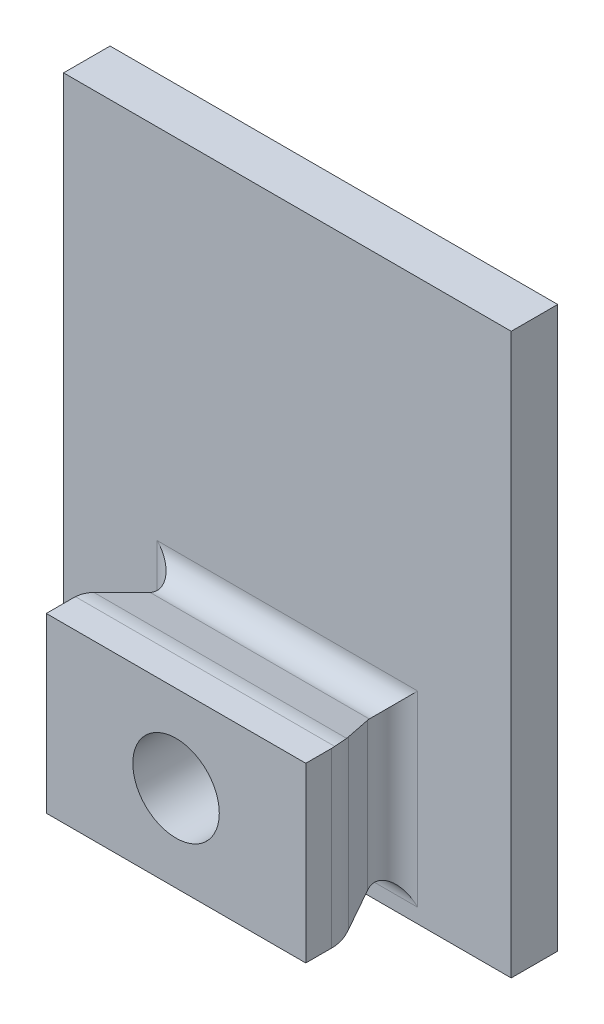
SolidWorks part; units mm, degrees
ref_plane "Plan de face" through (0, 0, 0) normal (0, 0, 1) x (1, 0, 0)
ref_plane "Plan de dessus" through (0, 0, 0) normal (0, 1, 0) x (1, 0, 0)
ref_plane "Plan de droite" through (0, 0, 0) normal (1, 0, 0) x (0, 0, -1)
sketch "Esquisse1" plane through (0, 0, 0) normal (0, 0, 1) x (1, 0, 0)
  line L1 (-60, 40) -> (60, 40)
  line L2 (-60, 40) -> (-60, -40)
  line L3 (-60, -40) -> (60, -40)
  line L4 (60, 40) -> (60, -40)
  dimension "D1" = 120
  dimension "D2" = 80
  dimension "D3" = 40
  dimension "D4" = 60
extrude "Boss.-Extru.1" add sketch "Esquisse1" along normal blind 17
ref_plane "Plan1" through (0, 0, -34.5) normal (0, 0, 1) x (1, 0, 0)
sketch "Esquisse2" plane through (0, 0, -34.5) normal (0, 0, 1) x (1, 0, 0)
  line L0 (60, -40) -> (60, 40) construction
  line L1 (45, -30) -> (-45, -30)
  line L2 (45, -30) -> (45, 30)
  line L3 (45, 30) -> (-45, 30)
  line L4 (-45, -30) -> (-45, 30)
  line L5 (-60, 40) -> (-60, -40) construction
  line L6 (-60, -40) -> (60, -40) construction
  line L7 (60, 40) -> (-60, 40) construction
  dimension "D1" = 15
  dimension "D2" = 15
  dimension "D3" = 10
  dimension "D4" = 10
sketch "Esquisse3" plane through (0, 0, 0) normal (0, 0, -1) x (-1, 0, 0)
  line L4 (60, -40) -> (60, 40)
  line L5 (60, 40) -> (-60, 40)
  line L6 (-60, 40) -> (-60, -40)
  line L7 (-60, -40) -> (60, -40)
  line L8 (60, -40) -> (60, 40)
  line L9 (60, 40) -> (-60, 40)
  line L10 (-60, 40) -> (-60, -40)
  line L11 (-60, -40) -> (60, -40)
  dimension "D1" = 0
loft "Lissage1" add profiles "Esquisse3", "Esquisse2"
sketch "Esquisse4" plane through (0, 0, -34.5) normal (0, 0, 1) x (1, 0, 0)
  line L0 (-60, -40) -> (60, -40) construction
  line L1 (103.5, -50) -> (-103.5, -50)
  line L2 (103.5, -50) -> (103.5, 209)
  line L3 (103.5, 209) -> (-103.5, 209)
  line L4 (-103.5, -50) -> (-103.5, 209)
  dimension "D1" = 259
  dimension "D2" = 207
  dimension "D3" = 103.5
  dimension "D4" = 10
extrude "Boss.-Extru.2" add sketch "Esquisse4" against normal blind 21.5
sketch "Esquisse5" plane through (0, 0, 17) normal (0, 0, 1) x (1, 0, 0)
  circle A0 centre (0, 0) radius 20
  dimension "D1" = 40
extrude "Enlèv. mat.-Extru.2" cut sketch "Esquisse5" against normal through all
fillet "Congé1" radius 25 4 edges at (0, -40, 0) (-60, 0, 0) (0, 40, 0) (60, 0, 0)
fillet "Congé2" radius 10 4 edges
